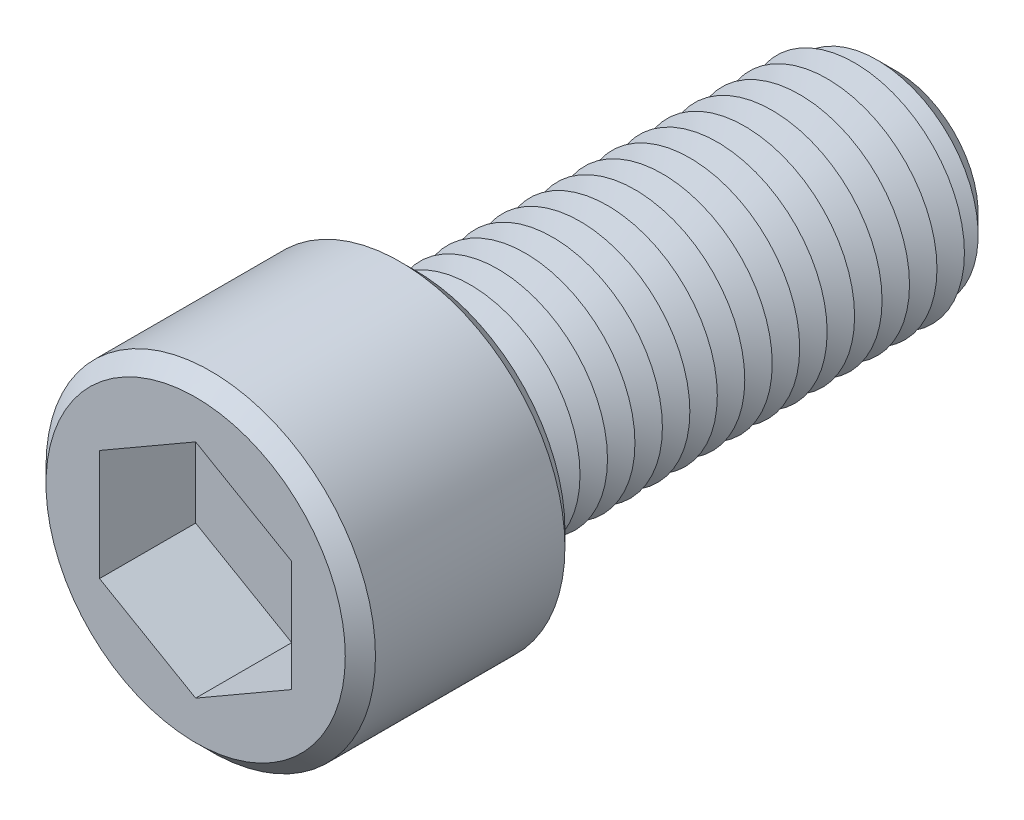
SolidWorks part; units mm, degrees
ref_plane "Front Plane" through (0, 0, 0) normal (0, 0, 1) x (1, 0, 0)
ref_plane "Top Plane" through (0, 0, 0) normal (0, 1, 0) x (1, 0, 0)
ref_plane "Right Plane" through (0, 0, 0) normal (1, 0, 0) x (0, 0, -1)
sketch "Sketch1" plane through (0, 0, 0) normal (0, 0, 1) x (1, 0, 0)
  circle A0 centre (0, 0) radius 12
  dimension "D1" = 24
extrude "Boss-Extrude1" add sketch "Sketch1" along normal blind 16
sketch "Sketch2" plane through (0, 0, 0) normal (0, 0, -1) x (-1, 0, 0)
  circle A0 centre (0, 0) radius 8
  dimension "D1" = 16
extrude "Boss-Extrude2" add sketch "Sketch2" along normal blind 35
chamfer "Chamfer1" distance 2 angle 45 1 edges at (-8, 0, -35)
sketch "Sketch3" plane through (0, 0, 0) normal (1, 0, 0) x (0, 0, -1)
  line L0 (-2.5121, 0) -> (4.5776, 0) construction
sketch "Sketch4" plane through (0, 0, 0) normal (1, 0, 0) x (0, 0, -1)
  line L0 (0, 8) -> (1, 6.2679)
  line L1 (1, 6.2679) -> (2, 8)
  line L2 (33, 8) -> (0, 8) construction
  line L3 (2, 8) -> (0, 8)
  dimension "D1" = 2
revolve "Cut-Revolve1" cut sketch "Sketch4" angle 360 about L0
pattern_linear "LPattern1" count 17 spacing 2 along (0, 0, -1) of "Cut-Revolve1"
sketch "Sketch5" plane through (0, 0, 16) normal (0, 0, 1) x (1, 0, 0)
  line L1 (0, 8.0829) -> (-7, 4.0415)
  line L2 (-7, 4.0415) -> (-7, -4.0415)
  line L3 (-7, -4.0415) -> (0, -8.0829)
  line L4 (0, -8.0829) -> (7, -4.0415)
  line L5 (7, -4.0415) -> (7, 4.0415)
  line L6 (7, 4.0415) -> (0, 8.0829)
  circle A0 centre (0, 0) radius 7 construction
  dimension "D1" = 14
extrude "Cut-Extrude1" cut sketch "Sketch5" against normal blind 7
sketch "Sketch6" plane through (0, 0, 9) normal (0, 0, 1) x (1, 0, 0)
  circle A0 centre (0, 0) radius 0.9
  dimension "D1" = 1.8
extrude "Cut-Extrude2" cut sketch "Sketch6" against normal up to surface (44 mm away)
chamfer "Chamfer2" distance 1.1 angle 45 2 edges at (12, 0, 0) (12, 0, 16)
